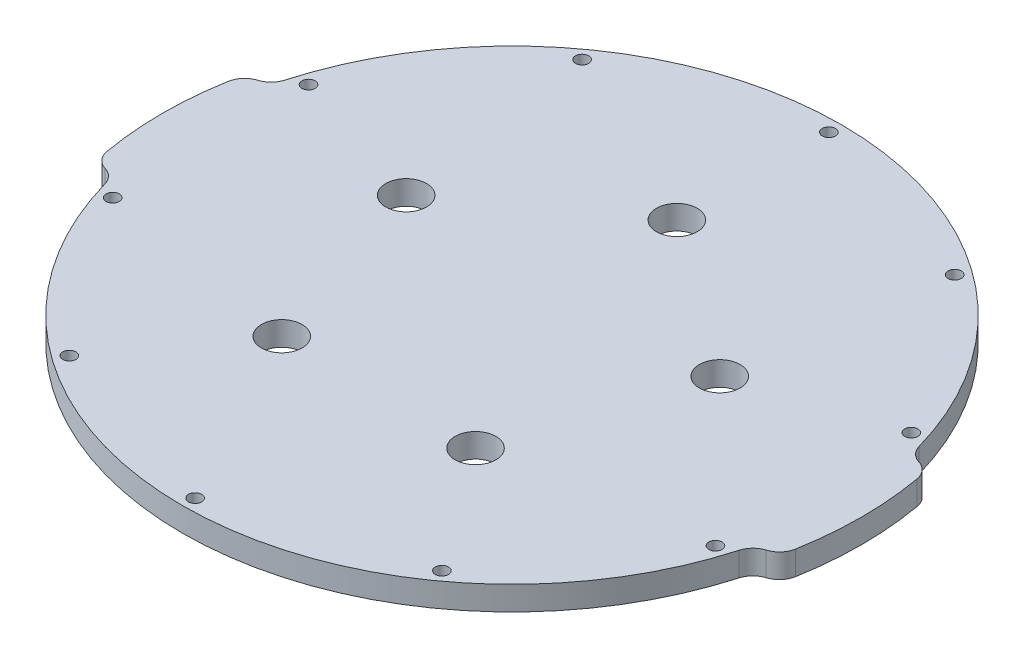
SolidWorks part; units mm, degrees
ref_plane "Front Plane" through (0, 0, 0) normal (0, 0, 1) x (1, 0, 0)
ref_plane "Top Plane" through (0, 0, 0) normal (0, 1, 0) x (1, 0, 0)
ref_plane "Right Plane" through (0, 0, 0) normal (1, 0, 0) x (0, 0, -1)
sketch "Sketch1" plane through (0, 0, 0) normal (0, 1, 0) x (1, 0, 0)
  line L0 (0, 0) -> (-86.2199, 15.2029) construction
  line L1 (0, 0) -> (-139.7786, 0) construction
  line L2 (0, 0) -> (-86.2199, -15.2029) construction
  line L3 (0, 0) -> (86.2199, 15.2029) construction
  line L4 (0, 0) -> (86.2199, -15.2029) construction
  circle A0 centre (0, 0) radius 79.35 construction
  circle A1 centre (0, 79.35) radius 1.65
  circle A2 centre (46.6408, 64.1955) radius 1.65
  circle A3 centre (75.4663, 24.5205) radius 1.65
  circle A4 centre (75.4663, -24.5205) radius 1.65
  circle A5 centre (46.6408, -64.1955) radius 1.65
  circle A6 centre (0, -79.35) radius 1.65
  circle A7 centre (-46.6408, -64.1955) radius 1.65
  circle A8 centre (-75.4663, -24.5205) radius 1.65
  circle A9 centre (-75.4663, 24.5205) radius 1.65
  circle A10 centre (-46.6408, 64.1955) radius 1.65
  circle A13 centre (0, 0) radius 82.55 construction
  circle A14 centre (0, 0) radius 87.55 construction
  arc A15 (-86.2199, -15.2029) -> (-86.2199, 15.2029) centre (0, 0) cw
  arc A16 (86.2199, -15.2029) -> (86.2199, 15.2029) centre (0, 0) ccw
  arc A17 (-86.2199, -15.2029) -> (-80.2789, -19.2301) centre (-81.2959, -14.3347) ccw
  arc A18 (-86.2199, 15.2029) -> (-80.2789, 19.2301) centre (-81.2959, 14.3347) cw
  arc A19 (86.2199, -15.2029) -> (80.2789, -19.2301) centre (81.2959, -14.3347) cw
  arc A20 (86.2199, 15.2029) -> (80.2789, 19.2301) centre (81.2959, 14.3347) ccw
  arc A21 (-80.2789, 19.2301) -> (80.2789, 19.2301) centre (0, 0) cw
  arc A22 (80.2789, -19.2301) -> (-80.2789, -19.2301) centre (0, 0) cw
  point P28 (0, 0)
  point P30 (0, 0)
  dimension "D1" = 3.3
  dimension "D2" = 158.7
  dimension "D4" = 165.1
  dimension "D5" = 5
  dimension "D6" = 10
extrude "Boss-Extrude1" add sketch "Sketch1" along normal blind 6
fillet "Fillet1" radius 5 4 edges at (80.2789, 3, 19.2301) (80.2789, 3, -19.2301) (-80.2789, 3, -19.2301) (-80.2789, 3, 19.2301)
sketch "Sketch2" plane through (0, 6, 0) normal (0, 1, 0) x (1, 0, 0)
  line L0 (0, 0) -> (0, -82.55) construction
  circle A0 centre (0, 41.275) radius 5.1
  circle A1 centre (0, 0) radius 41.275 construction
  circle A2 centre (39.2549, 12.7547) radius 5.1
  circle A3 centre (24.2608, -33.3922) radius 5.1
  circle A4 centre (-24.2608, -33.3922) radius 5.1
  circle A5 centre (-39.2549, 12.7547) radius 5.1
  arc A6 (-79.4157, -22.5311) -> (79.4157, -22.5311) centre (0, 0) ccw construction
  point P5 (0, -41.275)
  point P16 (0, 0)
  dimension "D1" = 10.2
  dimension "D2" = 5
extrude "Cut-Extrude1" cut sketch "Sketch2" against normal through all
